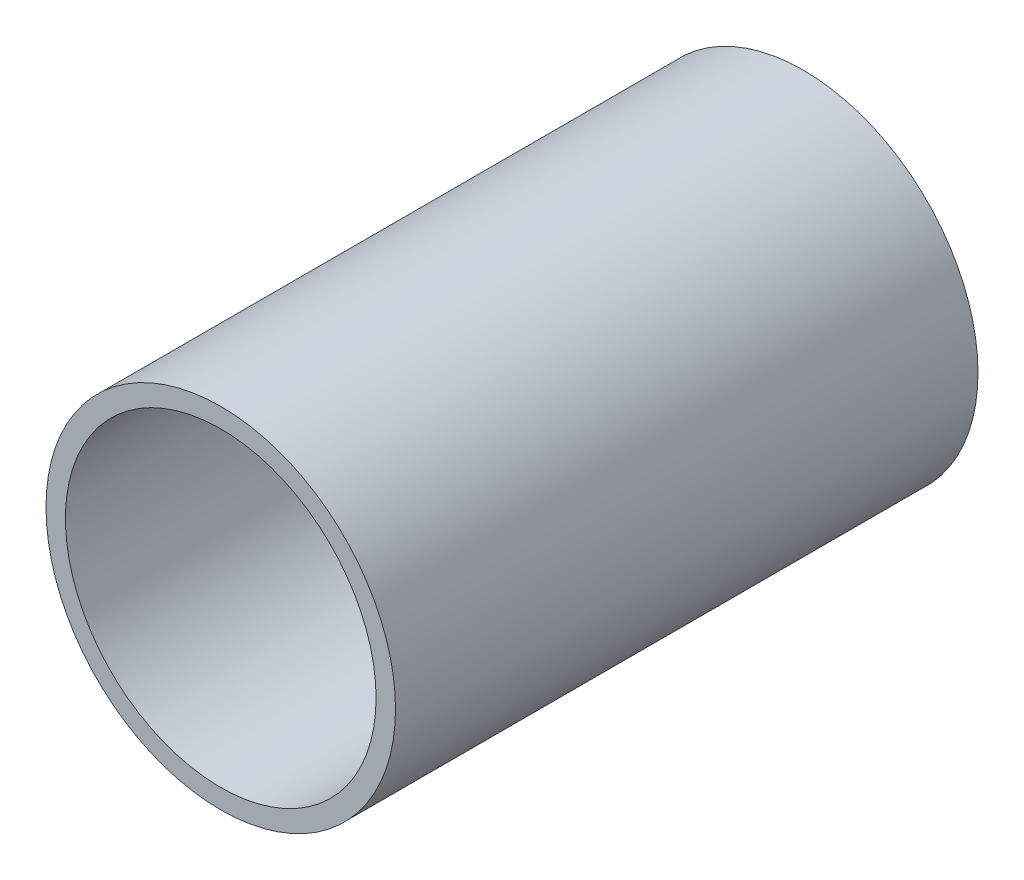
SolidWorks part; units mm, degrees
ref_plane "Plan1" through (0, 0, 0) normal (0, 0, 1) x (1, 0, 0)
ref_plane "Plan2" through (0, 0, 0) normal (0, 1, 0) x (1, 0, 0)
ref_plane "Plan3" through (0, 0, 0) normal (1, 0, 0) x (0, 0, -1)
sketch "Esquisse1" plane through (0, 0, 0) normal (0, 0, 1) x (1, 0, 0)
  circle A0 centre (0, 0) radius 36
  circle A1 centre (0, 0) radius 32
  dimension "D1" = 64
  dimension "D2" = 72
extrude "Base-Extrusion" add sketch "Esquisse1" along normal blind 120
